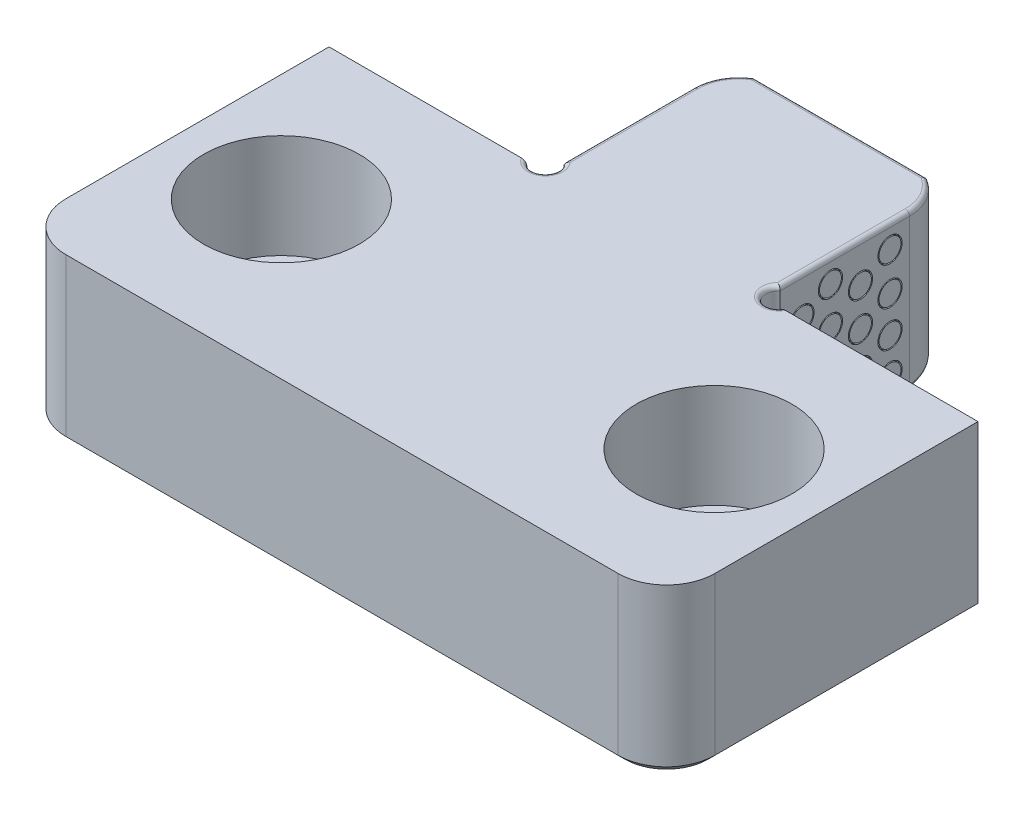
SolidWorks part; units mm, degrees
ref_plane "Front Plane" through (0, 0, 0) normal (0, 0, 1) x (1, 0, 0)
ref_plane "Top Plane" through (0, 0, 0) normal (0, 1, 0) x (1, 0, 0)
ref_plane "Right Plane" through (0, 0, 0) normal (1, 0, 0) x (0, 0, -1)
sketch "Sketch1" plane through (0, 0, 0) normal (0, 1, 0) x (1, 0, 0)
  line L0 (-37.5, -36) -> (37.5, -36)
  line L6 (-12.497, 0) -> (-12.497, 21.6)
  line L7 (-12.497, 21.6) -> (12.497, 21.6)
  line L8 (12.497, 21.6) -> (12.497, 0)
  line L9 (12.497, 0) -> (37.5, 0)
  line L10 (37.5, 0) -> (37.5, -36)
  line L12 (0, 0) -> (0, 50000) construction
  line L13 (0, 0) -> (-50000, 0) construction
  line L21 (-37.5, 0) -> (-37.5, -36)
  line L22 (-12.497, 0) -> (-37.5, 0)
  dimension "D1" = 24.994
  dimension "D2" = 36
  dimension "D3" = 57.6
  dimension "D4" = 75
extrude "Boss-Extrude1" add sketch "Sketch1" against normal blind 19 separate body
sketch "Sketch2" plane through (0, 0, 0) normal (0, 1, 0) x (1, 0, 0)
  line L0 (0, 0) -> (50000, 0) construction
  line L1 (0, 0) -> (0, 50000) construction
  line L4 (-12.497, 21.6) -> (-12.497, 0) construction
  line L5 (12.497, 21.6) -> (-12.497, 21.6) construction
  line L12 (12.497, 11.6) -> (12.497, 17.1)
  line L13 (12.497, 11.6) -> (25.4, 11.6)
  line L14 (25.4, 11.6) -> (25.4, 37)
  line L15 (-25.4, 37) -> (25.4, 37)
  line L16 (-25.4, 11.6) -> (-25.4, 37)
  line L17 (-12.497, 11.6) -> (-25.4, 11.6)
  line L18 (-12.497, 11.6) -> (-12.497, 17.1)
  line L19 (-9.9778, 21.6) -> (9.9778, 21.6)
  arc A0 (12.497, 17.1) -> (12.2054, 19.8058) centre (-0.203, 17.1) ccw construction
  arc A1 (12.2054, 19.8058) -> (9.9778, 21.6) centre (9.9778, 19.32) ccw construction
  arc A2 (12.497, 17.1) -> (9.9778, 21.6) centre (7.2183, 17.1) ccw
  arc A6 (-12.2054, 19.8058) -> (-9.9778, 21.6) centre (-9.9778, 19.32) cw construction
  arc A7 (-12.497, 17.1) -> (-12.2054, 19.8058) centre (0.203, 17.1) cw construction
  arc A8 (-12.497, 17.1) -> (-9.9778, 21.6) centre (-7.2183, 17.1) cw
  dimension "D1" = 10
  dimension "D3" = 50.8
  dimension "D4" = 2.28
  dimension "D5" = 12.7
  dimension "D6" = 4.5
  dimension "D2" = 25.4
extrude "Cut-Extrude1" cut sketch "Sketch2" against normal through all
sketch "Sketch3" plane through (0, 0, 0) normal (0, 1, 0) x (1, 0, 0)
  line L0 (0, 0) -> (0, 50000) construction
  line L1 (0, 0) -> (50000, 0) construction
  line L6 (37.5, -0.51) -> (12.497, -0.51)
  line L7 (37.5, -0.51) -> (12.497, -0.51) construction
  line L9 (11.987, 0) -> (11.987, 17.1)
  line L10 (11.987, 0) -> (11.987, 17.1) construction
  circle A0 centre (13.507, 1.01) radius 1.52
  circle A1 centre (-13.507, 1.01) radius 1.52
  dimension "D1" = 1.52
  dimension "D2" = 0.51
  dimension "D3" = 0.51
extrude "Cut-Extrude2" cut sketch "Sketch3" against normal through all
sketch "Sketch5" plane through (37.5, 0, 0) normal (1, 0, 0) x (0, 0, -1)
  line L0 (-63.088, -18.746) -> (49936.912, -18.746) construction
  line L1 (-36, -19) -> (0, -19) construction
  line L2 (21.6, -19) -> (21.6, 0) construction
  line L3 (0, 9.7237) -> (0, -49990.2763) construction
  line L4 (0, -19) -> (0, 0) construction
  line L5 (-18, 0) -> (-18, 50000) construction
  line L6 (-36, 0) -> (0, 0) construction
  line L7 (0, -18.746) -> (0, -58.4998)
  line L8 (0, -18.746) -> (2.7, -18.746)
  line L9 (50, -8.4998) -> (50, -58.4998)
  line L10 (50, -58.4998) -> (0, -58.4998)
  arc A0 (2.7, -18.746) -> (50, -8.4998) centre (2.7, 95.554) ccw
  point P16 (-18, 0)
  dimension "D2" = 114.3
  dimension "D3" = 18.9
  dimension "D1" = 0.254
  dimension "D4" = 50
  dimension "D5" = 50
extrude "Cut-Extrude3" cut sketch "Sketch5" against normal through all
fillet "Fillet1" radius 5.6 2 edges at (-37.5, -9.5, 36) (37.5, -9.5, 36)
fillet "Fillet2" radius 0.5 20 edges at (-11.3156, -17.3628, -20.4281) (12.1944, -17.5976, -18.8615) (12.497, 0, -9.623) (-11.8243, 0, -19.6786) (0, -17.1726, -21.6) (-12.497, -18.5181, -9.9144) (12.497, -18.5181, -9.9144) (11.8243, 0, -19.6786) (0, 0, -21.6) (-12.497, 0, -9.623) (13.507, -19, 0.51) (12.3711, -18.873, 0) (-12.3711, -18.873, 0) (-13.507, -19, 0.51) (-12.4322, 0, 0.0648) (12.4322, 0, 0.0648) (11.9896, -18.746, -1.099) (-11.9896, -18.746, -1.099) (-12.497, -18.746, -2.423) (12.497, -18.746, -2.423)
chamfer "Chamfer1" distance 0.8 angle 45 5 edges at (-37.5, -19, 15.2) (-35.8598, -19, 34.3598) (0, -19, 36) (35.8598, -19, 34.3598) (37.5, -19, 15.2)
hole_wizard "CBORE for M10 SHCS1" positions "Sketch10" profile "Sketch9" counterbore size "M10" standard "Ansi Metric"
sketch "Sketch10" plane through (0, 0, 0) normal (0, 1, 0) x (-1, 0, 0)
  line L0 (0, 0) -> (0, 50000) construction
  line L1 (31.9, 36) -> (-31.9, 36) construction
  line L2 (-37.5, 30.4) -> (-37.5, 0) construction
  point P0 (-25, 18)
  point P6 (0, 36)
  point P9 (25, 18)
  dimension "D1" = 12.5
  dimension "D2" = 18
sketch "Sketch9" plane through (25, 0, 18) normal (1, 0, 0) x (0, 0, 1)
  line L0 (0, 0) -> (0, 19.0485)
  line L1 (0, 19.0485) -> (5.5, 19.0485)
  line L3 (5.5, 19.0485) -> (5.5, 12)
  line L4 (5.5, 12) -> (9, 12)
  line L5 (9, 12) -> (9, 0)
  line L7 (9, 0) -> (0, 0)
  line L11 (0, -6.35) -> (0, 107.95) construction
  dimension "Thru Hole Dia." = 11
  dimension "Thru Hole Depth" = 19.0485
  dimension "C'Bore Dia." = 18
  dimension "C'Bore Depth" = 12
sketch "Sketch8" plane through (12.497, 0, 0) normal (1, 0, 0) x (0, 0, -1)
  circle A0 centre (14.8363, -2.7193) radius 1.4
  circle A1 centre (14.8363, -2.7193) radius 1.27
  circle A2 centre (14.8363, -15.3509) radius 1.4
  circle A3 centre (14.8363, -15.3509) radius 1.27
  circle A4 centre (14.8363, -7.0938) radius 1.4
  circle A5 centre (14.8363, -7.0938) radius 1.27
  circle A6 centre (14.8363, -11.2871) radius 1.4
  circle A7 centre (14.8363, -11.2871) radius 1.27
  circle A8 centre (11.4196, -4.583) radius 1.4
  circle A9 centre (11.4196, -4.583) radius 1.27
  circle A12 centre (11.4196, -8.9575) radius 1.4
  circle A13 centre (11.4196, -8.9575) radius 1.27
  circle A14 centre (11.4196, -13.1508) radius 1.4
  circle A15 centre (11.4196, -13.1508) radius 1.27
  circle A16 centre (7.951, -2.7193) radius 1.4
  circle A17 centre (7.951, -2.7193) radius 1.27
  circle A18 centre (7.951, -15.3509) radius 1.4
  circle A19 centre (7.951, -15.3509) radius 1.27
  circle A20 centre (7.951, -7.0938) radius 1.4
  circle A21 centre (7.951, -7.0938) radius 1.27
  circle A22 centre (7.951, -11.2871) radius 1.4
  circle A23 centre (7.951, -11.2871) radius 1.27
  circle A24 centre (4.6637, -4.583) radius 1.4
  circle A25 centre (4.6637, -4.583) radius 1.27
  circle A28 centre (4.6637, -8.9575) radius 1.4
  circle A29 centre (4.6637, -8.9575) radius 1.27
  circle A30 centre (4.6637, -13.1508) radius 1.4
  circle A31 centre (4.6637, -13.1508) radius 1.27
extrude "Cut-Extrude4" cut sketch "Sketch8" against normal blind 0.254
mirror "Mirror1" about plane through (0, 0, 0) normal (1, 0, 0) of "Cut-Extrude4"
